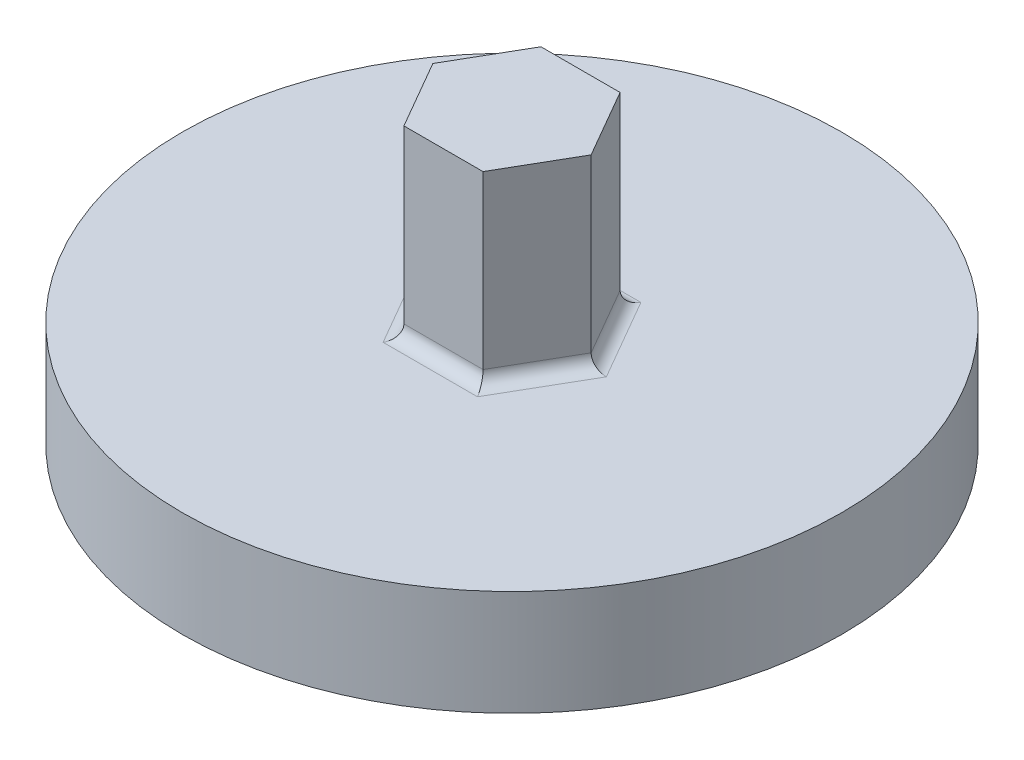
SolidWorks part; units mm, degrees
ref_plane "Alzado" through (0, 0, 0) normal (0, 0, 1) x (1, 0, 0)
ref_plane "Planta" through (0, 0, 0) normal (0, 1, 0) x (1, 0, 0)
ref_plane "Vista lateral" through (0, 0, 0) normal (1, 0, 0) x (0, 0, -1)
sketch "Croquis1" plane through (0, 0, 0) normal (0, 1, 0) x (1, 0, 0)
  circle A0 centre (0, 0) radius 12.5
extrude "Saliente-Extruir1" add sketch "Croquis1" along normal blind 4
sketch "Croquis2" plane through (0, 4, 0) normal (0, 1, 0) x (1, 0, 0)
  line L1 (3, 0) -> (1.5, 2.5981)
  line L2 (1.5, 2.5981) -> (-1.5, 2.5981)
  line L3 (-1.5, 2.5981) -> (-3, 0)
  line L4 (-3, 0) -> (-1.5, -2.5981)
  line L5 (-1.5, -2.5981) -> (1.5, -2.5981)
  line L6 (1.5, -2.5981) -> (3, 0)
  circle A0 centre (0, 0) radius 2.5981 construction
  dimension "D1" = 6
extrude "Saliente-Extruir2" add sketch "Croquis2" along normal blind 7
fillet "Redondeo1" radius 0.5 6 edges at (2.25, 4, -1.299) (0, 4, -2.5981) (-2.25, 4, -1.299) (-2.25, 4, 1.299) (2.25, 4, 1.299) (0, 4, 2.5981)
